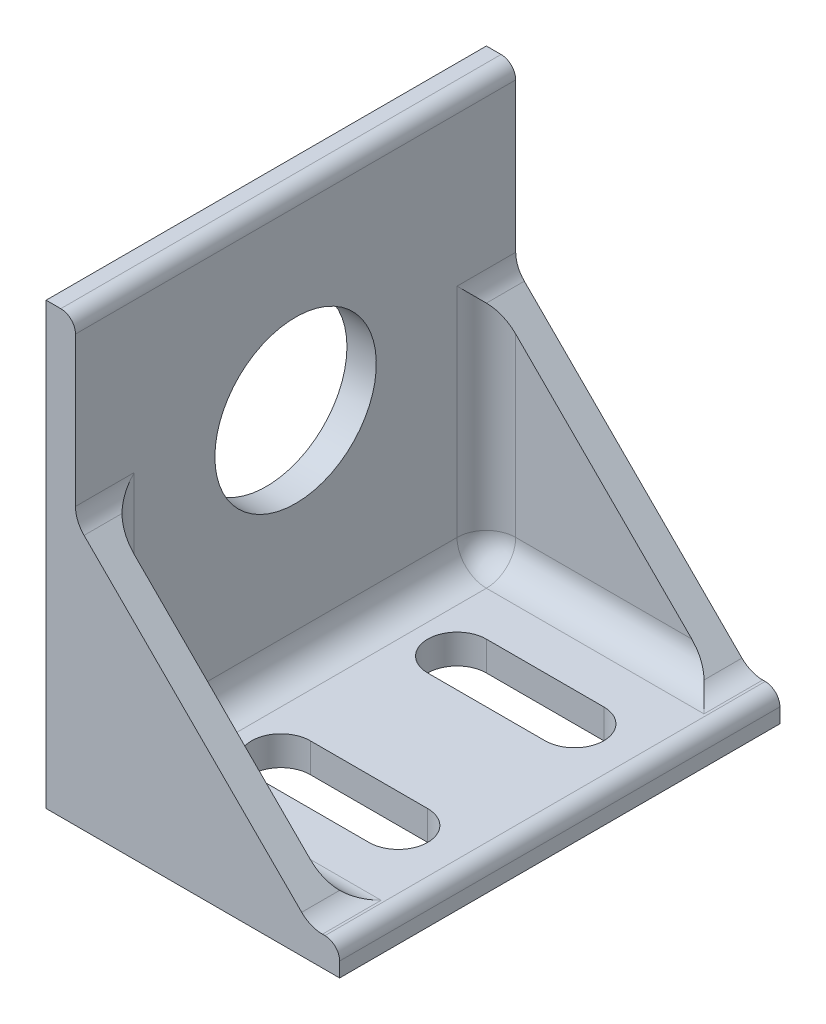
SolidWorks part; units mm, degrees
ref_plane "Plan de face" through (0, 0, 0) normal (0, 0, 1) x (1, 0, 0)
ref_plane "Plan de dessus" through (0, 0, 0) normal (0, 1, 0) x (1, 0, 0)
ref_plane "Plan de droite" through (0, 0, 0) normal (1, 0, 0) x (0, 0, -1)
sketch "Esquisse1" plane through (0, 0, 0) normal (0, 0, 1) x (1, 0, 0)
  line L0 (0, 0) -> (20, 0)
  line L1 (0, 0) -> (0, 30)
  line L2 (0, 30) -> (2, 30)
  line L3 (2, 30) -> (2, 18)
  line L4 (2, 18) -> (18, 2)
  line L5 (18, 2) -> (20, 2)
  line L6 (20, 2) -> (20, 0)
  dimension "D1" = 2
  dimension "D2" = 2
  dimension "D3" = 135
  dimension "D4" = 18
  dimension "D5" = 20
  dimension "D6" = 30
extrude "Boss.-Extru.1" add sketch "Esquisse1" along normal blind 30
sketch "Esquisse2" plane through (2, 0, 0) normal (1, 0, 0) x (0, 0, -1)
  line L0 (-30, 2) -> (0, 2) construction
  line L1 (-28, 23) -> (-2, 23)
  line L2 (-28, 23) -> (-28, 2)
  line L3 (-28, 2) -> (-2, 2)
  line L4 (-2, 23) -> (-2, 2)
  line L5 (-30, 2) -> (-30, 18) construction
  line L6 (0, 2) -> (0, 18) construction
  dimension "D1" = 2
  dimension "D2" = 2
  dimension "D3" = 21
extrude "Enlèv. mat.-Extru.1" cut sketch "Esquisse2" along normal blind 30
fillet "Congé1" radius 2 4 edges at (18, 2, 29) (18, 2, 1) (2, 18, 1) (2, 18, 29)
fillet "Congé2" radius 2 5 edges at (10.4142, 2, 2) (2, 10.4142, 2) (2, 2, 15) (10.4142, 2, 28) (2, 10.4142, 28)
fillet "Congé5" radius 1 2 edges at (20, 2, 15) (2, 30, 15)
sketch "Esquisse3" plane through (0, 0, 0) normal (-1, 0, 0) x (0, 0, 1)
  line L0 (0, 30) -> (0, 0) construction
  line L1 (30, 0) -> (0, 0) construction
  circle A0 centre (15, 17) radius 5.5
  dimension "D1" = 15
  dimension "D3" = 11
  dimension "D2" = 17
extrude "Enlèv. mat.-Extru.2" cut sketch "Esquisse3" against normal through all
sketch "Esquisse4" plane through (0, 2, 0) normal (0, 1, 0) x (1, 0, 0)
  line L0 (15, 6.3027) -> (15, -37.3664) construction
  line L1 (20, 0) -> (20, -30) construction
  line L3 (7, -28.5303) -> (7, -0.7426) construction
  line L4 (3.0007, -21) -> (12.1, -21) construction
  line L5 (8.4628, -9) -> (16.0886, -9) construction
  line L6 (7, -23) -> (15, -23)
  line L7 (7, -19) -> (15, -19)
  line L8 (0, -30) -> (20, -30) construction
  line L9 (0, 0) -> (20, 0) construction
  line L10 (7, -11) -> (15, -11)
  line L11 (7, -7) -> (15, -7)
  arc A0 (7, -11) -> (7, -7) centre (7, -9) cw
  arc A1 (15, -23) -> (15, -19) centre (15, -21) ccw
  arc A2 (7, -23) -> (7, -19) centre (7, -21) cw
  arc A3 (15, -11) -> (15, -7) centre (15, -9) ccw
  dimension "D2" = 9
  dimension "D3" = 9
  dimension "D4" = 2
  dimension "D5" = 2
  dimension "D1" = 5
  dimension "D6" = 8
extrude "Enlèv. mat.-Extru.3" cut sketch "Esquisse4" against normal through all
